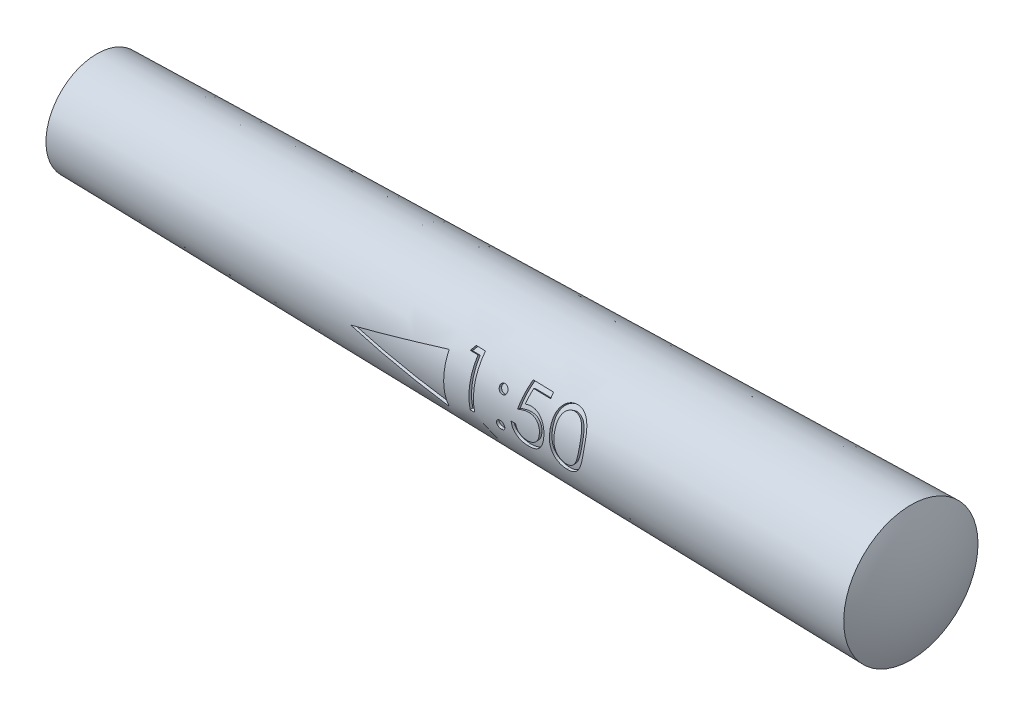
SolidWorks part; units mm, degrees
ref_plane "Front Plane" through (0, 0, 0) normal (0, 0, 1) x (1, 0, 0)
ref_plane "Top Plane" through (0, 0, 0) normal (0, 1, 0) x (1, 0, 0)
ref_plane "Right Plane" through (0, 0, 0) normal (1, 0, 0) x (0, 0, -1)
sketch "Sketch1" plane through (0, 0, 0) normal (1, 0, 0) x (0, 0, -1)
  circle A0 centre (0, 0) radius 1
  dimension "D1" = 2
extrude "Extrude1" add sketch "Sketch1" along normal mid plane 16
draft "Draft1" type of draft neutral plane draft angle 1.146 faces to draft 1 parameters "D1"=1.146
sketch "Sketch2" plane through (0, 0, 0) normal (0, 0, 1) x (1, 0, 0)
  line L0 (-8, 0) -> (-8, 1)
  line L1 (-8, 1) -> (-8, -1) construction
  line L2 (-8, 0) -> (-8.3, 0)
  line L3 (-8.3, 0) -> (-8.3, -1.16) construction
  line L4 (8, 0) -> (8, 1.32)
  line L5 (8, -1.32) -> (8, 1.32) construction
  line L6 (8, 0) -> (8.3, 0)
  line L7 (8.3, 0) -> (8.3, -1.16) construction
  line L8 (-8, -1) -> (8, -1.32) construction
  arc A0 (-8.3, 0) -> (-8, 1) centre (-6.4833, 0) cw
  arc A1 (8.3, 0) -> (8, 1.32) centre (5.246, 0) ccw
  point P14 (0, -1.16)
revolve "Revolve1" add sketch "Sketch2" angle 360 about L2
sketch "Sketch5" plane through (0, 0, 0) normal (0, 0, 1) x (1, 0, 0)
  line L0 (0, 1.16) -> (0, -1.16) construction
  line L1 (8, 1.32) -> (-8, 1) construction
  line L2 (-8, -1) -> (8, -1.32) construction
ref_plane "Plane2" through (0, 0, 0) normal (-0.02, 0, 0.9998) x (0.9998, 0, 0.02)
sketch "Sketch6" plane through (0, 0, 0) normal (-0.02, 0, 0.9998) x (0.9998, 0, 0.02)
  line L0 (0, 0) -> (0, 0.5)
  line L1 (0, 1.16) -> (0, -1.16) construction
  line L2 (0, 0.5) -> (-1.866, 0)
  line L3 (-1.866, 0) -> (0, -0.5)
  line L4 (0, -0.5) -> (0, 0)
  line L5 (0, -0.25) -> (3, -0.25) construction
  text T0 "1:50" font "Century Gothic" height 1
  dimension "D1" = 1
  dimension "D2" = 30
  dimension "D3" = 3
wrap "Wrap2" sketch "Sketch6" wrap type deboss source sketch "Sketch6" thickness 0.05 parameters "D1"=0.05
equation "\"D2@Sketch2\" = \"D1@Sketch2\""
